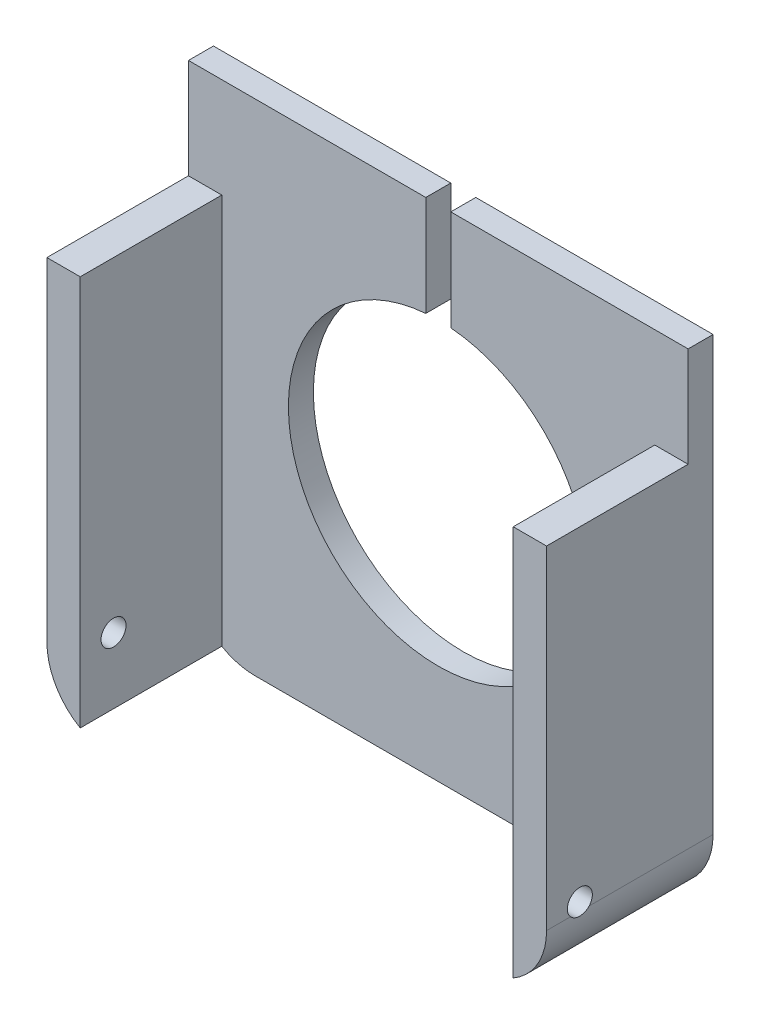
SolidWorks part; units mm, degrees
ref_plane "Ebene vorne" through (0, 0, 0) normal (0, 0, 1) x (1, 0, 0)
ref_plane "Ebene oben" through (0, 0, 0) normal (0, 1, 0) x (1, 0, 0)
ref_plane "Ebene rechts" through (0, 0, 0) normal (1, 0, 0) x (0, 0, -1)
sketch "Skizze1" plane through (0, 0, 0) normal (0, 0, 1) x (1, 0, 0)
  line L1 (-15, -15) -> (15, -15)
  line L2 (-15, -15) -> (-15, 15)
  line L3 (-15, 15) -> (15, 15)
  line L4 (15, -15) -> (15, 15)
  line L5 (-15, -15) -> (15, 15) construction
  line L6 (-15, 15) -> (15, -15) construction
  point P0 (0, 0)
  dimension "D1" = 30
  dimension "D2" = 30
extrude "Aufsatz-Linear austragen1" add sketch "Skizze1" against normal blind 10
sketch "Skizze2" plane through (0, 0, 0) normal (0, 0, 1) x (1, 0, 0)
  line L0 (-19.5322, 9) -> (-13, 9)
  line L1 (-13, 9) -> (-13, -16.2789)
  line L2 (-13, -16.2789) -> (13, -16.2789)
  line L3 (13, -16.2789) -> (13, 9)
  line L4 (13, 9) -> (17.2631, 9)
  line L5 (17.2631, 9) -> (17.2631, 15.4978)
  line L6 (17.2631, 15.4978) -> (-19.5322, 15.4978)
  line L7 (-19.5322, 15.4978) -> (-19.5322, 9)
  line L8 (-15, 15) -> (-15, -15) construction
  line L9 (15, -15) -> (15, 15) construction
  line L10 (-15, -15) -> (15, -15) construction
  point P10 (15, 0)
  dimension "D1" = 2
  dimension "D2" = 2
  dimension "D3" = 24
  dimension "D4" = 24
extrude "Schnitt-Linear austragen1" cut sketch "Skizze2" against normal blind 8.5
fillet "Verrundung1" radius 4 2 edges at (15, -15, -5) (-15, -15, -5)
sketch "Skizze3" plane through (0, 0, -10) normal (0, 0, -1) x (-1, 0, 0)
  circle A0 centre (0, 0) radius 9
  dimension "D1" = 18
  dimension "D2" = 0
extrude "Schnitt-Linear austragen2" cut sketch "Skizze3" against normal through all
sketch "Skizze4" plane through (0, 0, -10) normal (0, 0, -1) x (-1, 0, 0)
  line L0 (0, 0) -> (0, 16.1737) construction
  line L1 (-0.75, 15.4131) -> (-0.75, 8.4033)
  line L2 (-0.75, 8.4033) -> (0.75, 8.4033)
  line L3 (0.75, 8.4033) -> (0.75, 15.4131)
  line L4 (0.75, 15.4131) -> (-0.75, 15.4131)
  dimension "D1" = 0.75
  dimension "D2" = 0.75
extrude "Schnitt-Linear austragen3" cut sketch "Skizze4" against normal through all
sketch "Skizze5" plane through (15, 0, 0) normal (1, 0, 0) x (0, 0, -1)
  line L0 (10, 15) -> (8.5, 15) construction
  line L1 (0, -11) -> (0, 9) construction
  circle A0 centre (2, -10.5) radius 0.75
  dimension "D1" = 1.5
  dimension "D2" = 25.5
  dimension "D3" = 2
extrude "Schnitt-Linear austragen4" cut sketch "Skizze5" against normal through all
